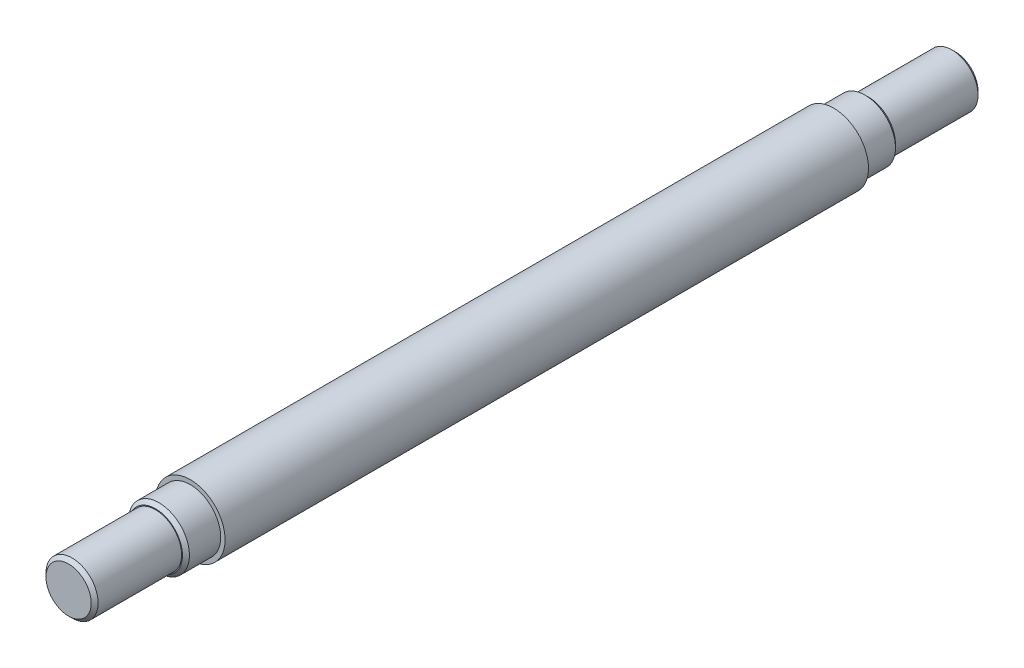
SolidWorks part; units mm, degrees
ref_plane "前视基准面" through (0, 0, 0) normal (0, 0, 1) x (1, 0, 0)
ref_plane "上视基准面" through (0, 0, 0) normal (0, 1, 0) x (1, 0, 0)
ref_plane "右视基准面" through (0, 0, 0) normal (1, 0, 0) x (0, 0, -1)
sketch "草图1" plane through (0, 0, 0) normal (0, 0, 1) x (1, 0, 0)
  circle A0 centre (0, 0) radius 20
extrude "凸台-拉伸1" add sketch "草图1" along normal blind 370
sketch "草图2" plane through (0, 0, 370) normal (0, 0, 1) x (1, 0, 0)
  circle A0 centre (0, 0) radius 17.5
extrude "凸台-拉伸2" add sketch "草图2" along normal blind 20
sketch "草图3" plane through (0, 0, 0) normal (0, 0, -1) x (-1, 0, 0)
  circle A0 centre (0, 0) radius 17.5
extrude "凸台-拉伸3" add sketch "草图3" along normal blind 20
sketch "草图4" plane through (0, 0, 390) normal (0, 0, 1) x (1, 0, 0)
  circle A0 centre (0, 0) radius 15
extrude "凸台-拉伸4" add sketch "草图4" along normal blind 50
sketch "草图5" plane through (0, 0, -20) normal (0, 0, -1) x (-1, 0, 0)
  circle A0 centre (0, 0) radius 15
extrude "凸台-拉伸5" add sketch "草图5" along normal blind 50
chamfer "倒角1" distance 2 angle 45 2 edges at (17.5, 0, 390) (-17.5, 0, -20)
chamfer "倒角2" distance 2 angle 45 2 edges at (-15, 0, -70) (15, 0, 440)
